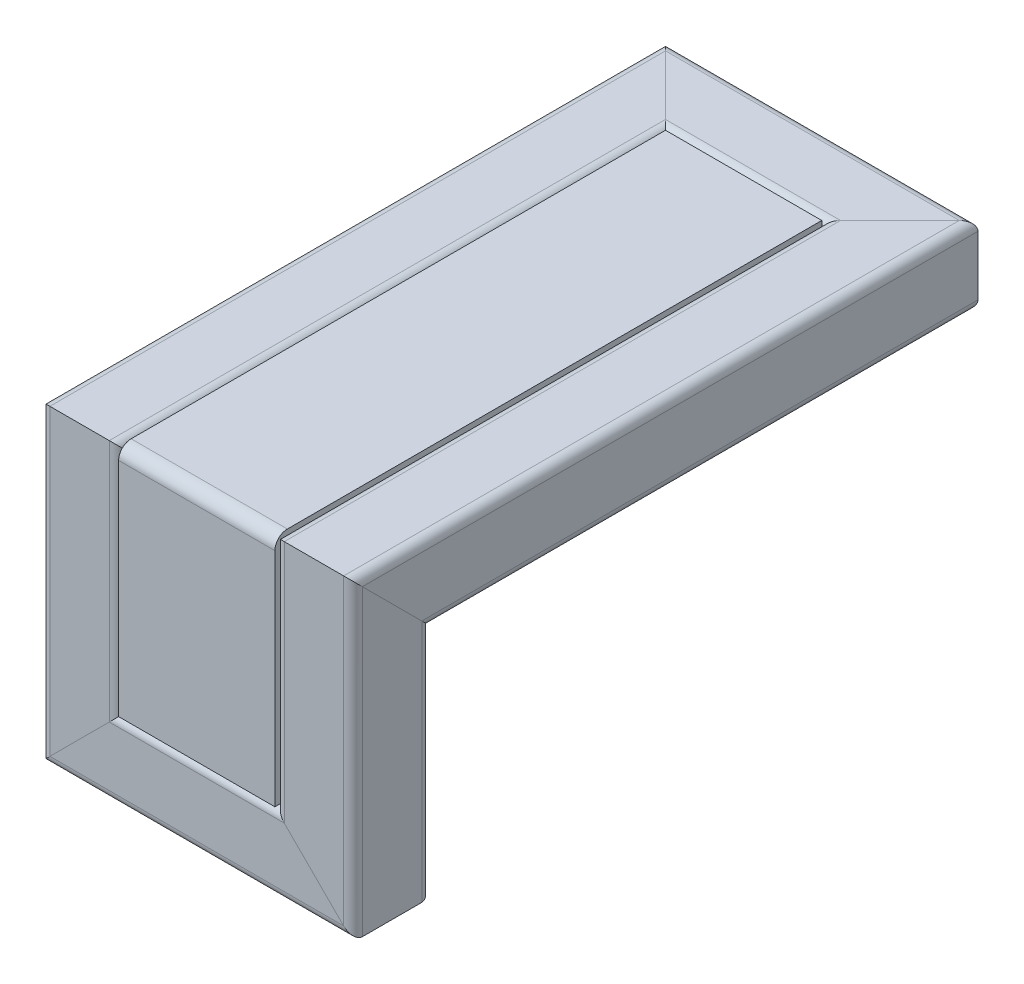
SolidWorks part; units mm, degrees
ref_plane "vorne" through (0, 0, 0) normal (0, 0, 1) x (1, 0, 0)
ref_plane "0.00" through (0, 0, 0) normal (0, 1, 0) x (1, 0, 0)
ref_plane "mitte" through (0, 0, 0) normal (1, 0, 0) x (0, 0, -1)
sketch3d "3D-Skizze1"
  line L0 (-50, 0, 0) -> (50, 0, 0)
  line L1 (50, 0, 0) -> (50, 100, 0)
  line L2 (50, 100, 0) -> (50, 100, -200)
  line L3 (50, 100, -200) -> (-50, 100, -200)
  line L4 (-50, 100, -200) -> (-50, 100, 0)
  line L5 (-50, 100, 0) -> (-50, 0, 0)
  dimension "D1" = 100
  dimension "D2" = 100
  dimension "D3" = 200
other "Strukturbauteil1"
ref_plane "Ebene1" through (-50, 0, 0) normal (1, 0, 0) x (0, 0, -1)
sketch "Skizze1" plane through (-50, 12.5, -12.5) normal (1, 0, 0) x (0, 0, -1)
  line L0 (10.5, -9.5) -> (10.5, 9.5)
  line L1 (9.5, -12.5) -> (-9.5, -12.5)
  line L2 (12.5, -9.5) -> (12.5, 9.5)
  line L3 (9.5, 12.5) -> (-9.5, 12.5)
  line L4 (-12.5, -9.5) -> (-12.5, 9.5)
  line L5 (9.5, 10.5) -> (-9.5, 10.5)
  line L6 (-10.5, -9.5) -> (-10.5, 9.5)
  line L7 (9.5, -10.5) -> (-9.5, -10.5)
  line L8 (0, -12.5) -> (0, 12.5) construction
  arc A0 (-12.5, 9.5) -> (-9.5, 12.5) centre (-9.5, 9.5) cw
  arc A1 (-9.5, -12.5) -> (-12.5, -9.5) centre (-9.5, -9.5) cw
  arc A2 (12.5, -9.5) -> (9.5, -12.5) centre (9.5, -9.5) cw
  arc A3 (9.5, 12.5) -> (12.5, 9.5) centre (9.5, 9.5) cw
  arc A4 (9.5, 10.5) -> (10.5, 9.5) centre (9.5, 9.5) cw
  arc A5 (-10.5, 9.5) -> (-9.5, 10.5) centre (-9.5, 9.5) cw
  arc A6 (-9.5, -10.5) -> (-10.5, -9.5) centre (-9.5, -9.5) cw
  arc A7 (10.5, -9.5) -> (9.5, -10.5) centre (9.5, -9.5) cw
  point P4 (0, 12.5)
  point P5 (0, -12.5)
  point P10 (-12.5, -12.5)
  point P13 (12.5, -12.5)
  point P16 (12.5, 12.5)
  point P25 (-12.5, -12.5)
  point P26 (-12.5, 12.5)
  point P27 (12.5, 12.5)
  point P30 (12.5, -12.5)
  point P31 (0, 0)
  point P32 (-12.5, 0)
  point P33 (12.5, 0)
  point P34 (0, 0)
  dimension "D3" = 3
  dimension "D1" = 25
  dimension "D2" = 25
  dimension "D4" = 2
sketch "Skizze2" plane through (0, 0, 0) normal (1, 0, 0) x (0, 0, -1)
  line L0 (0, 25) -> (0, 96)
  line L1 (4, 100) -> (175, 100)
  line L2 (0, 22) -> (0, 100) construction
  line L3 (0, 100) -> (178, 100) construction
  line L4 (175, 100) -> (175, 97) construction
  line L5 (0, 25) -> (3, 25) construction
  arc A0 (4, 100) -> (0, 96) centre (4, 96) ccw
  dimension "D1" = 4
extrude "Linear-Austragen-Dünn1" add sketch "Skizze2" against normal up to vertex and the other way up to vertex separate body thin
other "Körper speichern1"
